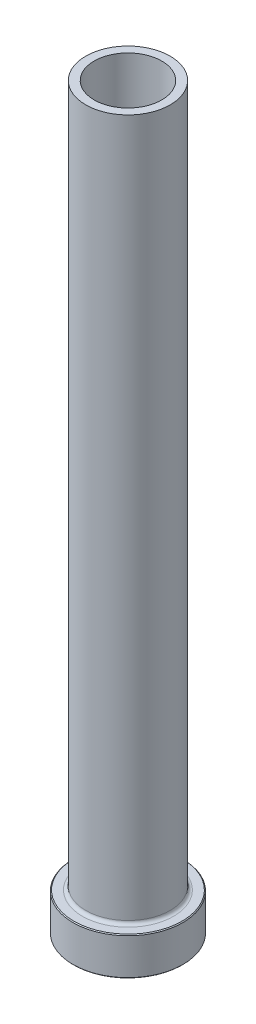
SolidWorks part; units mm, degrees
ref_plane "Front Plane" through (0, 0, 0) normal (0, 0, 1) x (1, 0, 0)
ref_plane "Top Plane" through (0, 0, 0) normal (0, 1, 0) x (1, 0, 0)
ref_plane "Right Plane" through (0, 0, 0) normal (1, 0, 0) x (0, 0, -1)
sketch "Sketch1" plane through (0, 0, 0) normal (0, 0, 1) x (1, 0, 0)
  line L0 (-8, 175) -> (-10, 175)
  line L1 (-10, 175) -> (-10, 9)
  line L2 (-10, 9) -> (-13, 9)
  line L3 (-13, 9) -> (-13, 0)
  line L4 (14.3, 0) -> (-14.3, 0) construction
  line L5 (-13, 0) -> (-8.25, 0)
  line L6 (-8, 120) -> (-8, 175)
  line L7 (0, 92.1877) -> (0, -15.5353) construction
  line L8 (0, -14.3) -> (0, 14.3) construction
  line L9 (-8, 120) -> (-8.25, 108)
  line L10 (-8.25, 108) -> (-8.25, 0)
  dimension "D1" = 0.25
  dimension "ID" = 16
  dimension "OD" = 20
  dimension "L" = 175
  dimension "H" = 26
  dimension "T" = 9
  dimension "N" = 55
  dimension "D2" = 12
revolve "Revolve1" add sketch "Sketch1" angle 360 about L7
fillet "Fillet1" radius 0.8 1 edges at (0, 9, 10)
chamfer "Chamfer1" distance 0.2 angle 45 2 edges at (0, 9, 13) (0, 0, 13)
chamfer "Chamfer3" distance 0.5 angle 45 1 edges at (0, 0, 8.25)
